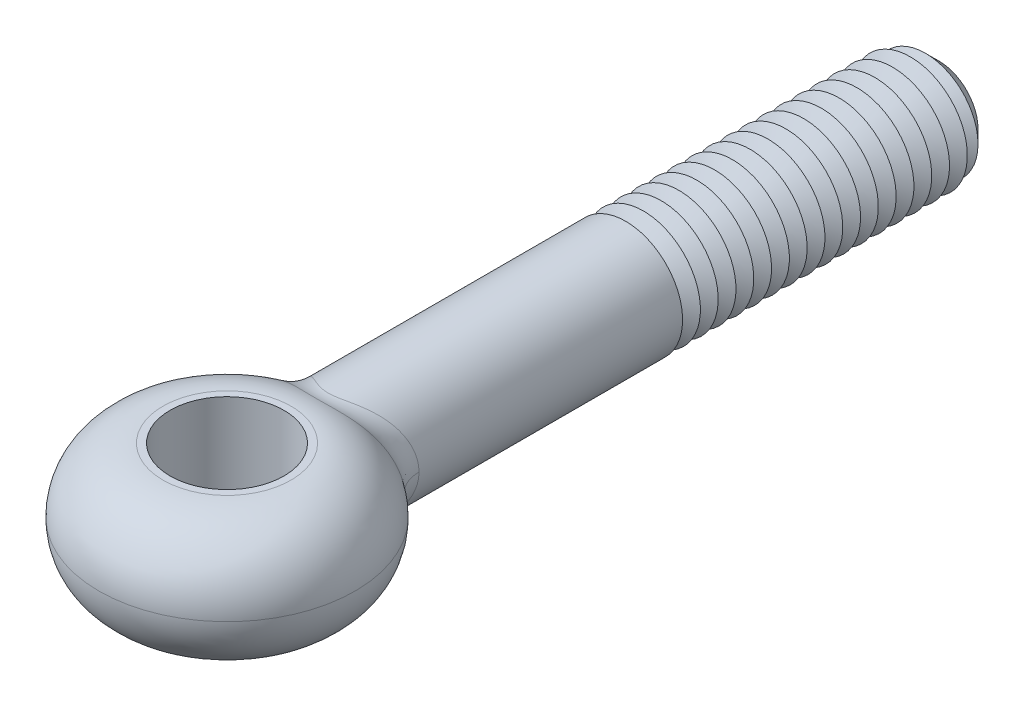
SolidWorks part; units mm, degrees
ref_plane "Front Plane" through (0, 0, 0) normal (0, 0, 1) x (1, 0, 0)
ref_plane "Top Plane" through (0, 0, 0) normal (0, 1, 0) x (1, 0, 0)
ref_plane "Right Plane" through (0, 0, 0) normal (1, 0, 0) x (0, 0, -1)
sketch "Sketch7" plane through (0, 0, 0) normal (0, 1, 0) x (1, 0, 0)
  circle A0 centre (0, 0) radius 9
  dimension "D1" = 18
extrude "Boss-Extrude3" add sketch "Sketch7" along normal mid plane 9
sketch "Sketch8" plane through (0, 0, 0) normal (0, 0, 1) x (1, 0, 0)
  circle A0 centre (0, 0) radius 4
  dimension "D1" = 8
extrude "Boss-Extrude4" add sketch "Sketch8" against normal blind 50
fillet "Fillet5" radius 4.5 2 edges at (0, -4.5, 9) (0, 4.5, 9)
fillet "Fillet6" radius 2.5 2 edges at (0.3214, -3.9871, -6.5786) (-0.3214, 3.9871, -6.5786)
chamfer "Chamfer1" distance 1.25 angle 45 1 edges at (4, 0, -50)
sketch "Sketch10" plane through (0, 0, 0) normal (0, 1, 0) x (1, 0, 0)
  line L0 (0, 28.1405) -> (0, -7.9233) construction
sketch "Sketch11" plane through (0, 0, 0) normal (0, 1, 0) x (1, 0, 0)
  line L0 (-4, 28) -> (-2.9175, 28.625)
  line L1 (-4, 48.75) -> (-4, 9.4868) construction
  line L2 (-2.9175, 28.625) -> (-4, 29.25)
  line L3 (-4, 29.25) -> (-4, 28)
  line L4 (2.75, 50) -> (-2.75, 50) construction
  dimension "D1" = 1.25
  dimension "D2" = 22
revolve "Cut-Revolve1" cut sketch "Sketch11" angle 360 about L0
pattern_linear "LPattern1" count 17 spacing 1.25 along (0, 0, -1) of "Cut-Revolve1"
sketch "Sketch12" plane through (0, 0, 0) normal (0, 1, 0) x (1, 0, 0)
  circle A0 centre (0, 0) radius 4
  dimension "D1" = 8
extrude "Cut-Extrude1" cut sketch "Sketch12" against normal mid plane 9
